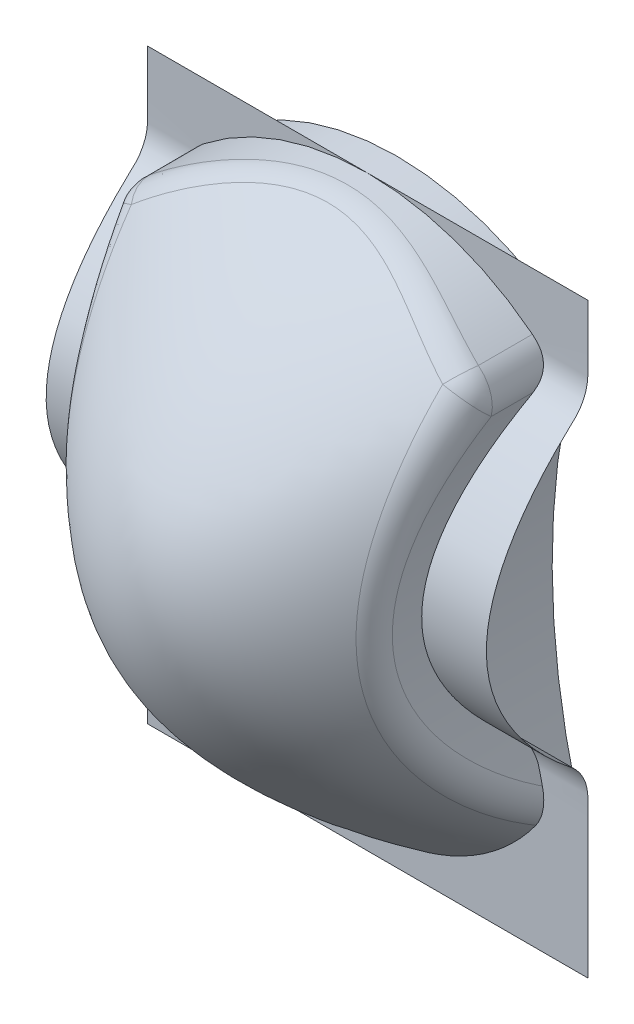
SolidWorks part; units mm, degrees
ref_plane "Płaszczyzna przednia" through (0, 0, 0) normal (0, 0, 1) x (1, 0, 0)
ref_plane "A" through (0, 0, 0) normal (0, 1, 0) x (1, 0, 0)
ref_plane "B" through (0, 0, 0) normal (1, 0, 0) x (0, 0, -1)
sketch "Szkic1" plane through (0, 0, 0) normal (0, 0, 1) x (1, 0, 0)
  line L0 (-25, 15) -> (25, 15) construction
  line L1 (-25, 80) -> (25, 80) construction
  line L2 (-25, 80) -> (-25, 0) construction
  line L3 (-25, 0) -> (25, 0) construction
  line L4 (25, 80) -> (25, 0) construction
  line L5 (-25, 70) -> (25, 70) construction
  arc A0 (-25, 15) -> (25, 15) centre (0, 28.3333) ccw
  arc A1 (-25, 70) -> (-25, 15) centre (-121.1444, 42.5) cw
  arc A2 (25, 70) -> (25, 15) centre (121.1444, 42.5) ccw
  arc A3 (-25, 70) -> (25, 70) centre (0, 43.75) cw
  dimension "D5" = 100
  dimension "D1" = 50
  dimension "D2" = 80
  dimension "D3" = 15
  dimension "D4" = 10
extrude "Dodanie-wyciągnięcie1" add sketch "Szkic1" along normal blind 60
ref_plane "C" through (-25, 0, 0) normal (1, 0, 0) x (0, 0, -1)
ref_plane "D" through (25, 0, 0) normal (1, 0, 0) x (0, 0, -1)
ref_plane "E" through (0, 80, 0) normal (0, 1, 0) x (1, 0, 0)
sketch "Szkic2" plane through (0, 80, 0) normal (0, 1, 0) x (1, 0, 0)
  line L0 (-25, -35.0108) -> (-25, 35.0108) construction
  line L1 (25, -33.5552) -> (25, 33.5552) construction
  line L2 (-25, 0) -> (25, 0) construction
  arc A0 (-25, -5) -> (25, -5) centre (0, 91.8246) ccw
  dimension "D1" = 100
  dimension "D2" = 5
sketch "Szkic3" plane through (0, 0, 0) normal (1, 0, 0) x (0, 0, -1)
  line L3 (0, 15) -> (0, 70) construction
  spline S0 degree 2 poles (-8.1754, 80) (-66.8799, 43.7358) (0, 0) knots 0 0 0 1 1 1
  dimension "D1" = 30
  dimension "D2" = 35
sketch "Szkic4" plane through (-25, 0, 0) normal (1, 0, 0) x (0, 0, -1)
  arc A0 (0, 15) -> (-5, 80) centre (20.6158, 49.2781) cw
  dimension "D1" = 40
sketch "Szkic5" plane through (25, 0, 0) normal (1, 0, 0) x (0, 0, -1)
  arc A0 (-5, 80) -> (0, 15) centre (20.6158, 49.2781) ccw construction
  arc A1 (-5, 80) -> (0, 15) centre (20.6158, 49.2781) ccw
surface "Powierzchnia-Wyciągnięcie po profilach1"
other "Cięcie powierzchnią1"
fillet "Zaokrąglenie1" radius 5 2 edges at (-25, 70, 6.8047) (25, 70, 6.8047)
fillet "Zaokrąglenie2" radius 5 7 edges at (-21.1653, 40.4591, 23.2497) (-0.448, 79.9972, 8.1789) (21.2905, 37.0977, 22.3017) (23.7755, 70.6252, 13.9786) (-24.1502, 69.7107, 14.3424)
shell "Skorupa1" thickness 2
sketch "Szkic6" plane through (0, 0, 0) normal (1, 0, 0) x (0, 0, -1)
  line L0 (-5, 0) -> (-5, 21.2908) construction
  line L1 (0, 80) -> (-6.7405, 80) construction
  line L2 (-5, 71.1546) -> (-5, 80) construction
  arc A0 (-5, 71.1546) -> (-6.63, 67.4609) centre (-10, 71.1546) cw construction
  arc A1 (-5, 21.2908) -> (-6.9115, 25.2228) centre (-10, 21.2908) ccw construction
  spline S1 degree 3 number of poles 78 (-5, 0) -> (-5, 80)
  spline S2 degree 3 poles (-1338.1776, 1544.3173) (388.5717, 33.348) (40.4534, 136.9653) (-14.4872, 58.4764) (-15.119, 57.478) (-15.9793, 55.933) (-16.2518, 55.409) (-16.7581, 54.357) (-16.9927, 53.8276) (-17.4242, 52.7584) (-17.6205, 52.2202) (-17.9718, 51.1344) (-18.1271, 50.5856) (-18.3929, 49.481) (-18.5045, 48.9189) (-18.6772, 47.7986) (-18.7387, 47.2401) (-18.8484, 45.569) (-18.8217, 44.4581) (-18.6263, 42.7872) (-18.5346, 42.2262) (-18.3014, 41.1151) (-18.1603, 40.5657) (-17.6687, 38.9372) (-17.2506, 37.8785) (-16.4995, 36.3207) (-16.2282, 35.8063) (-15.6468, 34.7891) (-15.3397, 34.2917) (-14.3713, 32.8256) (-13.6664, 31.8882) (-12.151, 30.0762) (-11.3422, 29.2041) (-9.6345, 27.5227) (-8.7319, 26.7107) (-6.8714, 25.1705) (-5.9128, 24.441) (-3.9396, 23.0572) (-2.9282, 22.4052) (60.9002, -15.2153) (207.065, 102.6445) (1551.6076, 1281.6554) knots -4.861238 -4.861238 -4.861238 -4.861238 0.125 0.125 0.1875 0.1875 0.21875 0.21875 0.25 0.25 0.28125 0.28125 0.3125 0.3125 0.34375 0.34375 0.375 0.375 0.4375 0.4375 0.46875 0.46875 0.5 0.5 0.5625 0.5625 0.59375 0.59375 0.625 0.625 0.6875 0.6875 0.75 0.75 0.8125 0.8125 0.875 0.875 0.9375 0.9375 4.716482 4.716482 4.716482 4.716482 only from (-9.2096, 64.9647) to (1.2991, 20.088)
  spline S3 degree 3 poles (-6.63, 67.4609) (-9.3494, 64.9799) (-11.7828, 62.34) (-14.4872, 58.4764) (-15.119, 57.478) (-15.9793, 55.933) (-16.2518, 55.409) (-16.7581, 54.357) (-16.9927, 53.8276) (-17.4242, 52.7584) (-17.6205, 52.2202) (-17.9718, 51.1344) (-18.1271, 50.5856) (-18.3929, 49.481) (-18.5045, 48.9189) (-18.6772, 47.7986) (-18.7387, 47.2401) (-18.8484, 45.569) (-18.8217, 44.4581) (-18.6263, 42.7872) (-18.5346, 42.2262) (-18.3014, 41.1151) (-18.1603, 40.5657) (-17.6687, 38.9372) (-17.2506, 37.8785) (-16.4995, 36.3207) (-16.2282, 35.8063) (-15.6468, 34.7891) (-15.3397, 34.2917) (-14.3713, 32.8256) (-13.6664, 31.8882) (-12.151, 30.0762) (-11.3422, 29.2041) (-9.6345, 27.5227) (-8.7319, 26.7107) (-7.5077, 25.6973) (-7.211, 25.4581) (-6.9115, 25.2228) knots -0.061025 -0.061025 -0.061025 -0.061025 0.125 0.125 0.1875 0.1875 0.21875 0.21875 0.25 0.25 0.28125 0.28125 0.3125 0.3125 0.34375 0.34375 0.375 0.375 0.4375 0.4375 0.46875 0.46875 0.5 0.5 0.5625 0.5625 0.59375 0.59375 0.625 0.625 0.6875 0.6875 0.75 0.75 0.8125 0.8125 0.832246 0.832246 0.832246 0.832246 construction
  dimension "D3" = 5
  dimension "D2" = 5
  dimension "D1" = 3
surface "Powierzchnia-Odsunięcie1" parameters "D1"=1
surface "Powierzchnia-Wyciągnięcie1" sketch "Szkic6" parameters "D1"=60
surface "Powierzchnia-Odsunięcie2" parameters "D1"=1
surface "Powierzchnia-Przytnij1"
surface "Powierzchnia-Przytnij2"
surface "Powierzchnia-Przytnij3"
surface "Powierzchnia-Przytnij4"
surface "Powierzchnia-Połącz1"
split "Podziel1" trimming surface bodies 115 bodies to split 103 resulting bodies 116 117
